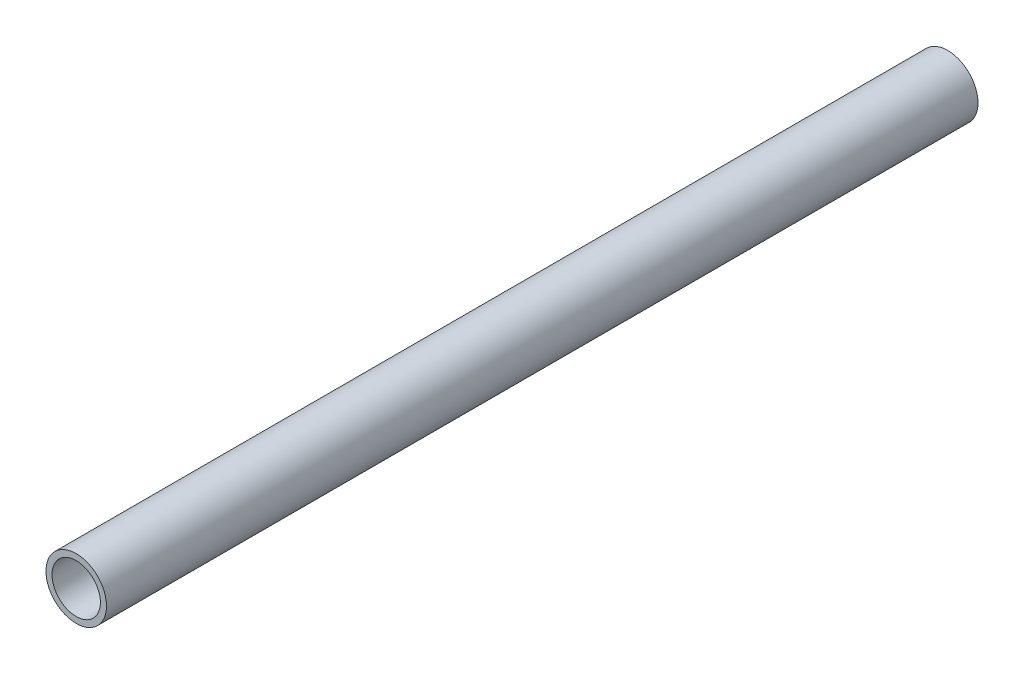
SolidWorks part; units mm, degrees
ref_plane "Face" through (0, 0, 0) normal (0, 0, 1) x (1, 0, 0)
ref_plane "Dessus" through (0, 0, 0) normal (0, 1, 0) x (1, 0, 0)
ref_plane "Droite" through (0, 0, 0) normal (1, 0, 0) x (0, 0, -1)
sketch "Esquisse1" plane through (0, 0, 0) normal (0, 0, 1) x (1, 0, 0)
  circle A0 centre (0, 0) radius 0.4
  circle A1 centre (0, 0) radius 0.5
  dimension "D1" = 0.8
  dimension "D2" = 1
extrude "Extrusion1" add sketch "Esquisse1" along normal blind 14.4
